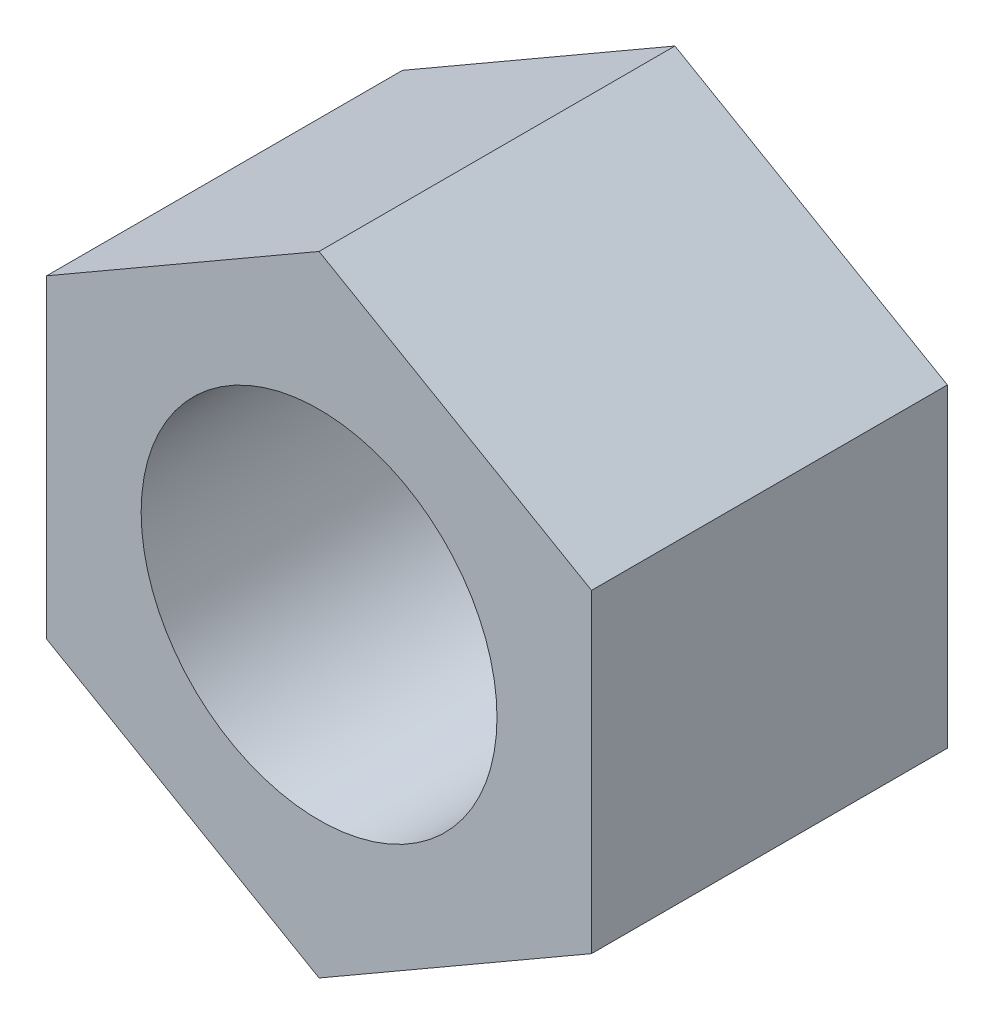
SolidWorks part; units mm, degrees
ref_plane "Front Plane" through (0, 0, 0) normal (1, 0, 0) x (0, 1, 0)
ref_plane "Top Plane" through (0, 0, 0) normal (0, 0, 1) x (0, 1, 0)
ref_plane "Right Plane" through (0, 0, 0) normal (0, 1, 0) x (-1, 0, 0)
sketch "Sketch1" plane through (0, 0, 0) normal (0, 0, 1) x (0, 1, 0)
  line L1 (22.4553, -38.8937) -> (44.9106, 0)
  line L2 (44.9106, 0) -> (22.4553, 38.8937)
  line L3 (22.4553, 38.8937) -> (-22.4553, 38.8937)
  line L4 (-22.4553, 38.8937) -> (-44.9106, 0)
  line L5 (-44.9106, 0) -> (-22.4553, -38.8938)
  line L6 (-22.4553, -38.8938) -> (22.4553, -38.8937)
  circle A0 centre (0, 0) radius 25.4
  circle A1 centre (0, 0) radius 38.8938 construction
  dimension "D1" = 50.8
  dimension "D2" = 77.7875
extrude "Boss-Extrude1" add sketch "Sketch1" along normal mid plane 50.8
